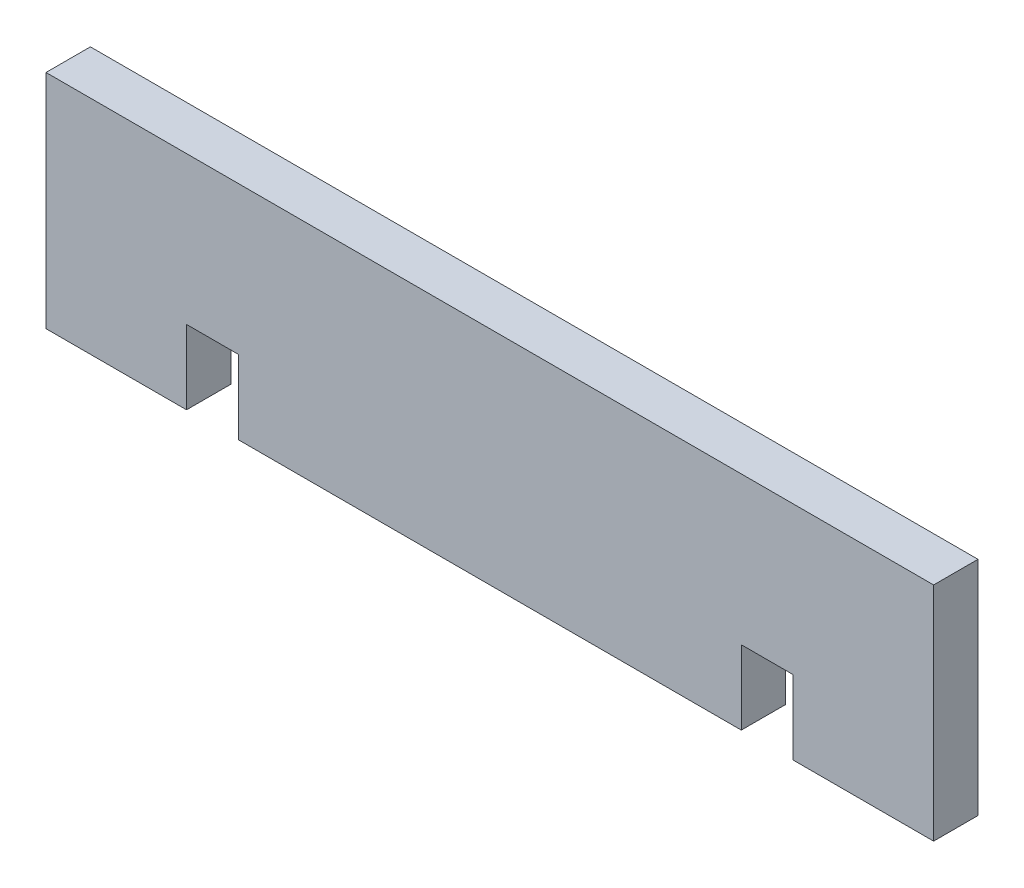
SolidWorks part; units mm, degrees
ref_plane "Plan de face" through (0, 0, 0) normal (0, 0, 1) x (1, 0, 0)
ref_plane "Plan de dessus" through (0, 0, 0) normal (0, 1, 0) x (1, 0, 0)
ref_plane "Plan de droite" through (0, 0, 0) normal (1, 0, 0) x (0, 0, -1)
sketch "Esquisse1" plane through (0, 0, 0) normal (0, 0, 1) x (1, 0, 0)
  line L1 (0, 0) -> (60, 0)
  line L2 (0, 0) -> (0, 15)
  line L3 (0, 15) -> (60, 15)
  line L4 (60, 0) -> (60, 15)
  dimension "D1" = 60
  dimension "D2" = 15
extrude "Extrusion1" add sketch "Esquisse1" along normal blind 3
sketch "Esquisse2" plane through (0, 0, 3) normal (0, 0, 1) x (1, 0, 0)
  line L0 (0, 0) -> (60, 0) construction
  line L1 (9.5, 0) -> (13, 0)
  line L2 (9.5, 0) -> (9.5, 5)
  line L3 (9.5, 5) -> (13, 5)
  line L4 (13, 0) -> (13, 5)
  line L6 (47, 0) -> (50.5, 0)
  line L7 (47, 0) -> (47, 5)
  line L8 (47, 5) -> (50.5, 5)
  line L9 (50.5, 0) -> (50.5, 5)
  dimension "D1" = 3.5
  dimension "D2" = 3.5
  dimension "D3" = 9.5
  dimension "D4" = 9.5
  dimension "D5" = 5
  dimension "D6" = 5
extrude "Enlèv. mat.-Extru.1" cut sketch "Esquisse2" against normal blind 3
